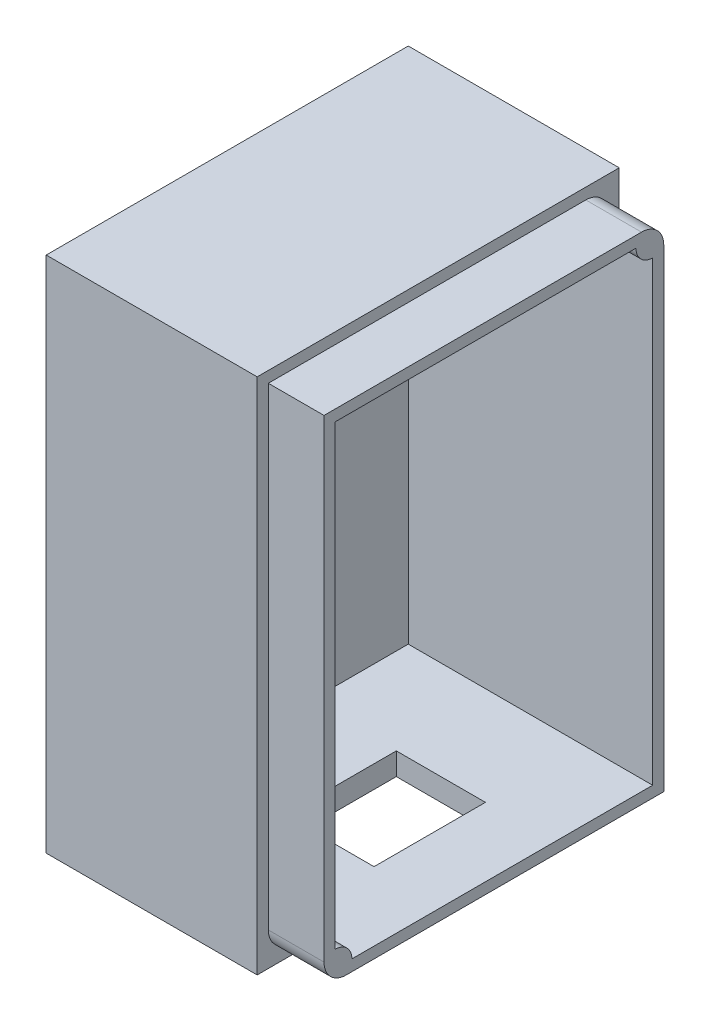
SolidWorks part; units mm, degrees
ref_plane "Front Plane" through (0, 0, 0) normal (0, 0, 1) x (1, 0, 0)
ref_plane "Top Plane" through (0, 0, 0) normal (0, 1, 0) x (1, 0, 0)
ref_plane "Right Plane" through (0, 0, 0) normal (1, 0, 0) x (0, 0, -1)
sketch "Sketch9" plane through (0, 0, 0) normal (1, 0, 0) x (0, 0, -1)
  line L9 (-14.5022, 16.1416) -> (13.9978, 16.1416)
  line L10 (-14.5022, 16.1416) -> (-14.5022, -26.3584)
  line L11 (-14.5022, -26.3584) -> (13.9978, -26.3584)
  line L12 (13.9978, 16.1416) -> (13.9978, -26.3584)
  dimension "D1" = 28.5
  dimension "D2" = 42.5
extrude "Boss-Extrude2" add sketch "Sketch9" along normal blind 20
shell "Shell1" thickness 2
sketch "Sketch13" plane through (-2, 0, 0) normal (-1, 0, 0) x (0, 0, 1)
  line L1 (-15.9978, 18.1416) -> (16.5022, 18.1416) construction
  line L2 (16.5022, -28.3584) -> (-15.9978, -28.3584) construction
  line L3 (13.9714, -17.2631) -> (14.5363, -14.4321)
  line L4 (14.5363, -14.4321) -> (12.3671, -12.5275)
  line L5 (12.3671, -12.5275) -> (9.633, -13.4537)
  line L6 (9.633, -13.4537) -> (9.0681, -16.2847)
  line L7 (9.0681, -16.2847) -> (11.2373, -18.1893)
  line L8 (11.2373, -18.1893) -> (13.9714, -17.2631)
  line L9 (16.5022, 18.1416) -> (16.5022, -28.3584) construction
  circle A0 centre (0.2522, 6.1416) radius 4
  circle A1 centre (11.8022, -15.3584) radius 2.5 construction
  dimension "D1" = 8
  dimension "D3" = 5
  dimension "D4" = 13
  dimension "D2" = 12
  dimension "D5" = 4.7
extrude "Cut-Extrude3" cut sketch "Sketch13" against normal blind 20
sketch "Sketch14" plane through (0, 0, 16.5022) normal (0, 0, 1) x (1, 0, 0)
  line L0 (5.9379, 21.0105) -> (5.9379, -38.5274)
  line L1 (5.9379, -38.5274) -> (34.5779, -38.5274)
  line L2 (34.5779, -38.5274) -> (26.806, 26.1707)
  line L3 (26.806, 26.1707) -> (5.9379, 21.0105)
extrude "Cut-Extrude4" cut sketch "Sketch14" against normal blind 45
sketch "Sketch16" plane through (-2, 0, 0) normal (-1, 0, 0) x (0, 0, 1)
  circle A0 centre (0.2522, 6.1416) radius 5
  dimension "D1" = 10
extrude "Cut-Extrude5" cut sketch "Sketch16" against normal blind 9
sketch "Sketch17" plane through (-2, 0, 0) normal (-1, 0, 0) x (0, 0, 1)
  line L1 (13.8253, -17.775) -> (15.2017, -14.1925)
  line L2 (15.2017, -14.1925) -> (12.7874, -11.2092)
  line L3 (12.7874, -11.2092) -> (8.9966, -11.8085)
  line L4 (8.9966, -11.8085) -> (7.6202, -15.391)
  line L5 (7.6202, -15.391) -> (10.0346, -18.3742)
  line L6 (10.0346, -18.3742) -> (13.8253, -17.775)
  circle A0 centre (11.411, -14.7917) radius 3.3236 construction
extrude "Cut-Extrude6" cut sketch "Sketch17" against normal blind 9 contours L1 L2 L3 L4 L5 L6
sketch "Sketch18" plane through (0, 0, 0) normal (1, 0, 0) x (0, 0, -1)
  line L0 (-0.2522, 16.1416) -> (-0.2522, -5.9401) construction
  line L1 (13.9978, 16.1416) -> (-14.5022, 16.1416) construction
  line L3 (-5.6868, 11.5863) -> (5.1823, 11.5863)
  line L4 (-5.6868, 11.5863) -> (-5.6868, 0.6969)
  line L5 (-5.6868, 0.6969) -> (5.1823, 0.6969)
  line L6 (5.1823, 11.5863) -> (5.1823, 0.6969)
  line L7 (-5.6868, 11.5863) -> (5.1823, 0.6969) construction
  line L8 (-5.6868, 0.6969) -> (5.1823, 11.5863) construction
  point P4 (-0.2522, 6.1416)
extrude "Cut-Extrude7" cut sketch "Sketch18" against normal blind 1
sketch "Sketch19" plane through (5.9379, 0, 0) normal (1, 0, 0) x (0, 0, -1)
  line L0 (-14.5022, 16.1416) -> (13.9978, 16.1416)
  line L1 (13.9978, 16.1416) -> (13.9978, -26.3584)
  line L2 (13.9978, -26.3584) -> (-14.5022, -26.3584)
  line L3 (-14.5022, -26.3584) -> (-14.5022, 16.1416)
  line L4 (-16.5022, 18.1416) -> (-16.5022, -28.3584)
  line L5 (-16.5022, -28.3584) -> (15.9978, -28.3584)
  line L6 (15.9978, -28.3584) -> (15.9978, 18.1416)
  line L7 (-16.5022, 18.1416) -> (15.9978, 18.1416) construction
  line L8 (15.9978, 18.1416) -> (15.9978, -28.3584) construction
  line L9 (15.9978, 18.1416) -> (-16.5022, 18.1416)
extrude "Boss-Extrude3" add sketch "Sketch19" along normal blind 16
sketch "Sketch21" plane through (21.9379, 0, 0) normal (1, 0, 0) x (0, 0, -1)
  circle A0 centre (-14.5022, -26.3584) radius 1.5
  dimension "D1" = 3
extrude "Boss-Extrude4" add sketch "Sketch21" against normal up to vertex (23.9379 mm away)
sketch "Sketch22" plane through (21.9379, 0, 0) normal (1, 0, 0) x (0, 0, -1)
  circle A0 centre (13.9978, 16.1416) radius 1.4992
extrude "Boss-Extrude5" add sketch "Sketch22" against normal up to vertex (23.9379 mm away)
sketch "Sketch24" plane through (0, -28.3584, 0) normal (0, -1, 0) x (1, 0, 0)
  line L6 (7.7624, 4.837) -> (15.7624, 4.837)
  line L7 (7.7624, 4.837) -> (7.7624, -5.163)
  line L8 (7.7624, -5.163) -> (15.7624, -5.163)
  line L9 (15.7624, 4.837) -> (15.7624, -5.163)
  point P10 (9.969, 0.2522)
  dimension "D1" = 8
  dimension "D2" = 10
extrude "Cut-Extrude9" cut sketch "Sketch24" against normal blind 25 contours L7 L6 L9 L8
sketch "Sketch25" plane through (21.9379, 0, 0) normal (1, 0, 0) x (0, 0, -1)
  line L0 (15.9978, 18.1416) -> (15.9978, -28.3584)
  line L3 (15.9978, -28.3584) -> (14.9978, -28.3584)
  line L5 (-14.5022, 17.1416) -> (14.9978, 17.1416)
  line L6 (15.9978, -28.3584) -> (15.9978, 18.1416) construction
  line L7 (14.9978, 17.1416) -> (14.9978, -27.3584)
  line L8 (-16.5022, -28.3584) -> (15.9978, -28.3584) construction
  line L9 (14.9978, -28.3584) -> (14.9978, -27.3584)
  line L10 (15.9978, 18.1416) -> (-16.5022, 18.1416)
  line L11 (-16.5022, 18.1416) -> (-16.5022, 17.1416)
  line L12 (-16.5022, 18.1416) -> (-16.5022, -28.3584) construction
  line L13 (-16.5022, 17.1416) -> (-14.5022, 17.1416)
  dimension "D2" = 1
  dimension "D3" = 1
extrude "Cut-Extrude11" cut sketch "Sketch25" against normal blind 5
sketch "Sketch26" plane through (21.9379, 0, 0) normal (1, 0, 0) x (0, 0, -1)
  line L0 (14.9978, -28.3584) -> (14.9978, -27.3584)
  line L1 (14.9978, 17.1416) -> (14.9978, -28.3584) construction
  line L2 (14.9978, -27.3584) -> (-15.5022, -27.3584)
  line L3 (-16.5022, 17.1416) -> (-16.5022, -28.3584) construction
  line L5 (-15.5022, -27.3584) -> (-15.5022, 17.1416)
  line L6 (-16.5022, 17.1416) -> (14.9978, 17.1416) construction
  line L7 (-15.5022, 17.1416) -> (-16.5022, 17.1416)
  line L8 (-16.5022, 17.1416) -> (-16.5022, -28.3584)
  line L9 (-16.5022, -28.3584) -> (14.9978, -28.3584)
  dimension "D1" = 1
  dimension "D2" = 1
extrude "Cut-Extrude12" cut sketch "Sketch26" against normal blind 5
fillet "Fillet1" radius 2 2 edges at (19.4379, 17.1416, -14.9978) (19.4379, -27.3584, 15.5022)
